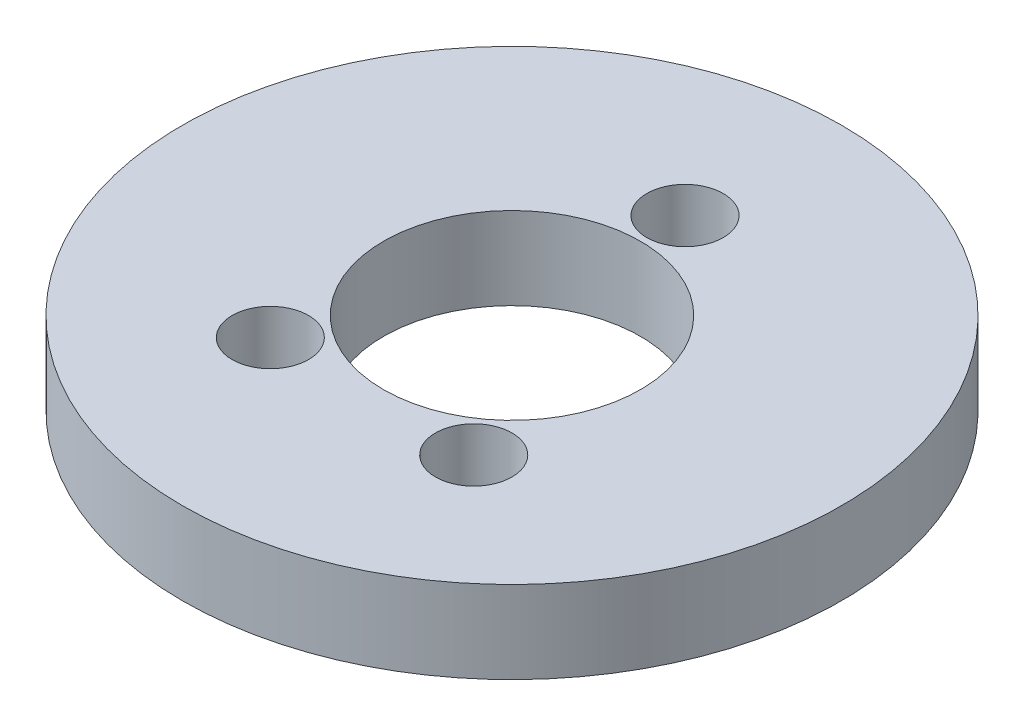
SolidWorks part; units mm, degrees
ref_plane "Front Plane" through (0, 0, 0) normal (0, 0, 1) x (1, 0, 0)
ref_plane "Top Plane" through (0, 0, 0) normal (0, 1, 0) x (1, 0, 0)
ref_plane "Right Plane" through (0, 0, 0) normal (1, 0, 0) x (0, 0, -1)
sketch "Sketch1" plane through (0, 0, 0) normal (0, 1, 0) x (1, 0, 0)
  circle A0 centre (0, 0) radius 4.953
  circle A1 centre (0, 0) radius 12.7
  circle A2 centre (0, 0) radius 6.6675 construction
  circle A3 centre (0, 6.6675) radius 1.4732
  circle A4 centre (6.3412, 2.0604) radius 1.4732 construction
  circle A5 centre (3.9191, -5.3941) radius 1.4732
  circle A6 centre (-3.9191, -5.3941) radius 1.4732
  circle A7 centre (-6.3412, 2.0604) radius 1.4732 construction
  point P17 (0, 0)
  dimension "D1" = 9.906
  dimension "D2" = 25.4
  dimension "D3" = 13.335
  dimension "D4" = 2.9464
  dimension "D5" = 5
extrude "Boss-Extrude1" add sketch "Sketch1" along normal blind 3.175
